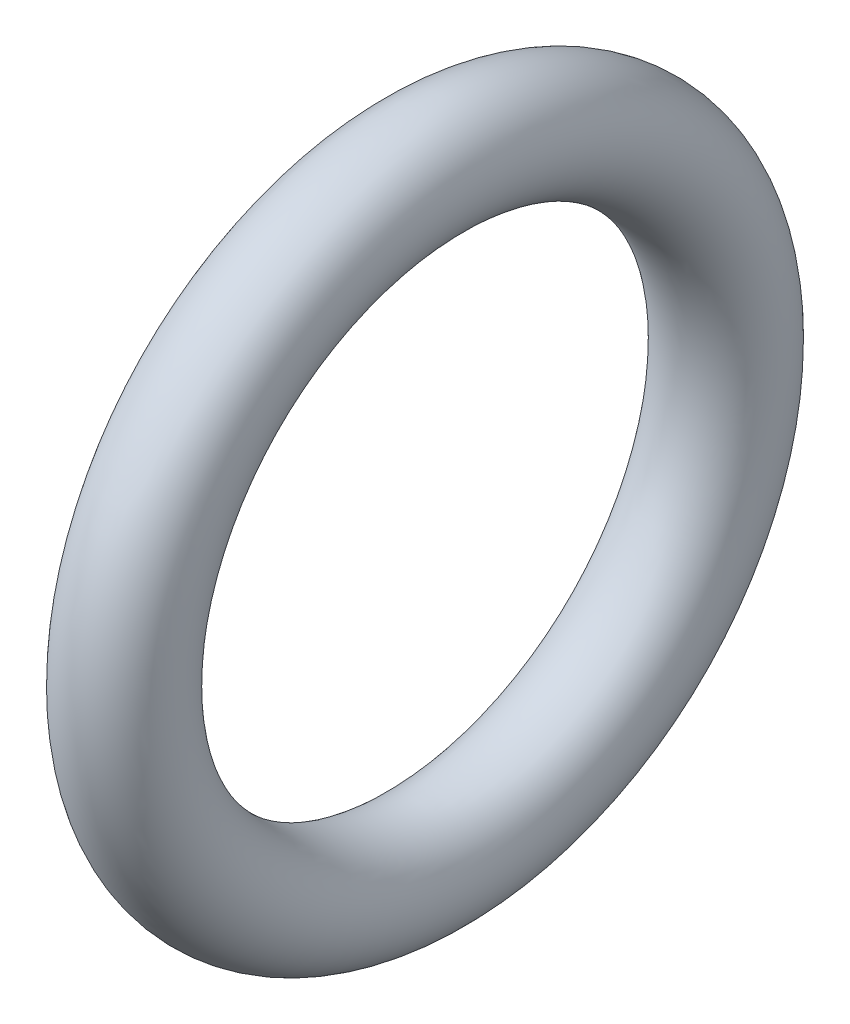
SolidWorks part; units mm, degrees
ref_plane "Face" through (0, 0, 0) normal (0, 0, 1) x (1, 0, 0)
ref_plane "Cote" through (0, 0, 0) normal (0, 1, 0) x (1, 0, 0)
ref_plane "Dessus" through (0, 0, 0) normal (1, 0, 0) x (0, 0, -1)
sketch "Esquisse1" plane through (0, 0, 0) normal (0, 0, 1) x (1, 0, 0)
  line L0 (0, 0) -> (-53.2607, 0) construction
  line L1 (-1.35, 7.4) -> (1.35, 7.4) construction
  line L2 (0, 7.4) -> (0, 0.958) construction
  line L4 (0, -50) -> (0, 50) construction
  circle A0 centre (0, 7.4) radius 1.35
  dimension "Ø du tore" = 2.7
  dimension "Ø int  a" = 12.1
revolve "Base-Révolution" add sketch "Esquisse1" angle 360 about L0
ref_plane "Plan pour mis en place" through (-1.35, 0, 0) normal (1, 0, 0) x (0, 0, -1)
